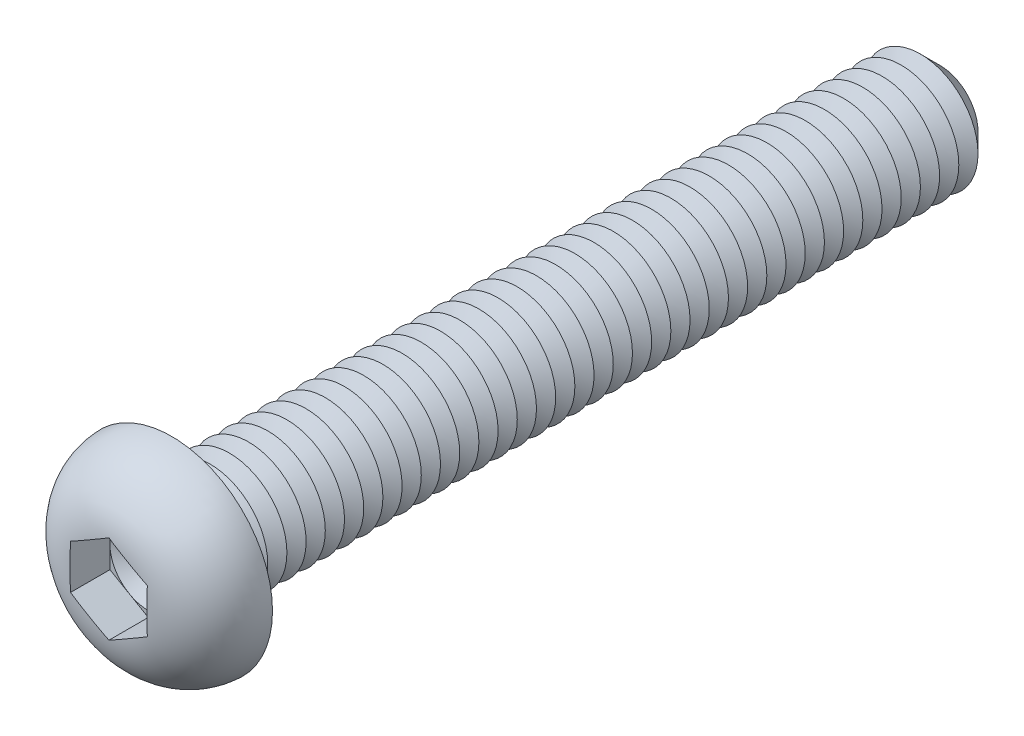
SolidWorks part; units mm, degrees
ref_plane "Front Plane" through (0, 0, 0) normal (0, 0, 1) x (1, 0, 0)
ref_plane "Top Plane" through (0, 0, 0) normal (0, 1, 0) x (1, 0, 0)
ref_plane "Right Plane" through (0, 0, 0) normal (1, 0, 0) x (0, 0, -1)
sketch "Sketch1" plane through (0, 0, 0) normal (1, 0, 0) x (0, 0, -1)
  line L0 (-47.9342, 0) -> (60.3146, 0) construction
sketch "Sketch2" plane through (0, 0, 0) normal (1, 0, 0) x (0, 0, -1)
  line L0 (0, 0) -> (-3.3, 0)
  line L1 (-47.9342, 0) -> (60.3146, 0) construction
  line L2 (-3.3, 0) -> (-3.3, 1.8515)
  line L3 (0, 5.25) -> (0, 0)
  arc A0 (-3.3, 1.8515) -> (0, 5.25) centre (0.1, 1.8515) cw
  dimension "D1" = 3.4
  dimension "D2" = 3.3
  dimension "D3" = 5.25
revolve "Revolve1" add sketch "Sketch2" angle 360 about L0
sketch "Sketch3" plane through (0, 0, 3.3) normal (0, 0, 1) x (1, 0, 0)
  line L1 (0, 2.3094) -> (-2, 1.1547)
  line L2 (-2, 1.1547) -> (-2, -1.1547)
  line L3 (-2, -1.1547) -> (0, -2.3094)
  line L4 (0, -2.3094) -> (2, -1.1547)
  line L5 (2, -1.1547) -> (2, 1.1547)
  line L6 (2, 1.1547) -> (0, 2.3094)
  circle A0 centre (0, 0) radius 2 construction
  dimension "D1" = 4
extrude "Cut-Extrude1" cut sketch "Sketch3" against normal blind 2.08
sketch "Sketch4" plane through (0, 0, 0) normal (0, 0, -1) x (-1, 0, 0)
  circle A0 centre (0, 0) radius 3
  dimension "D1" = 6
extrude "Boss-Extrude1" add sketch "Sketch4" along normal blind 40
chamfer "Chamfer1" distance 1 angle 45 1 edges at (-3, 0, -40)
sketch "Sketch5" plane through (0, 0, 0) normal (1, 0, 0) x (0, 0, -1)
  line L0 (1, 3) -> (2, 3)
  line L1 (39, 3) -> (0, 3) construction
  line L2 (2, 3) -> (1.5, 2.134)
  line L3 (1.5, 2.134) -> (1, 3)
  line L4 (0, -5.25) -> (0, 5.25) construction
  line L5 (39, 3) -> (0, 3) construction
  dimension "D1" = 1
  dimension "D2" = 1
revolve "Cut-Revolve1" cut sketch "Sketch5" angle 360 about L0
pattern_linear "LPattern1" count 38 spacing 1 along (0, 0, -1) of "Cut-Revolve1"
fillet "Fillet2" radius 0.5 1 edges at (-3, 0, 0)
sketch "Sketch6" plane through (0, 0, 1.22) normal (0, 0, 1) x (1, 0, 0)
  line L0 (0, -2.3094) -> (2, -1.1547) construction
  circle A0 centre (0, 0) radius 2
extrude "Cut-Extrude2" cut sketch "Sketch6" against normal through all draft 60
